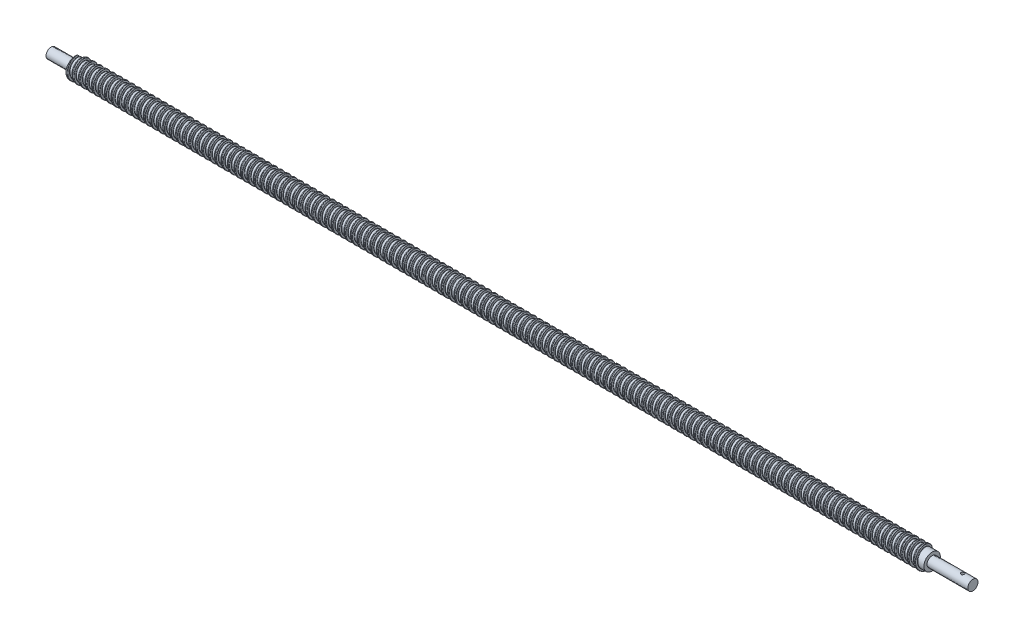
SolidWorks part; units mm, degrees
ref_plane "Plan de face" through (0, 0, 0) normal (0, 0, 1) x (1, 0, 0)
ref_plane "Plan de dessus" through (0, 0, 0) normal (0, 1, 0) x (1, 0, 0)
ref_plane "Plan de droite" through (0, 0, 0) normal (1, 0, 0) x (0, 0, -1)
sketch "Esquisse1" plane through (0, 0, 0) normal (0, 0, 1) x (1, 0, 0)
  line L0 (-448, 6.5) -> (-448, 0)
  line L1 (-448, 0) -> (275.5, 0)
  line L2 (275.5, 0) -> (275.5, 6.5)
  line L3 (275.5, 6.5) -> (-448, 6.5)
  line L4 (-448, 0) -> (275.5, 0) construction
  dimension "D1" = 6.5
  dimension "D2" = 723.5
revolve "Révolution1" add sketch "Esquisse1" angle 360 about L4
thread "Filetage1" pitch 5.08 start angle 0, offset 0, length 0, pitch 5.08, diameter 13
ref_plane "Plan2" through (-448, 0, -6.5) normal (0, -1, 0) x (0, 0, -1)
sketch "Profil de filetage2" plane through (-448, 0, -6.5) normal (0, -1, 0) x (0, 0, -1)
  line L0 (0, 0) -> (0, 5.08) construction
  line L1 (0, 0) -> (0, 3.5768)
  line L2 (0.254, 3.5768) -> (1.524, 3.5768) construction
  line L3 (1.524, 2.8818) -> (1.524, 2.1553)
  line L4 (1.3141, 3.1319) -> (0.2099, 3.3266)
  line L5 (1.3008, 1.6164) -> (0.2232, 0.5388)
  line L6 (0.762, 0) -> (1.524, 0) construction
  arc A0 (0.2099, 3.3266) -> (0, 3.5768) centre (0.254, 3.5768) cw
  arc A1 (0.2232, 0.5388) -> (0, 0) centre (0.762, 0) ccw
  arc A2 (1.524, 2.1553) -> (1.3008, 1.6164) centre (0.762, 2.1553) cw
  arc A3 (1.524, 2.8818) -> (1.3141, 3.1319) centre (1.27, 2.8818) ccw
  point P10 (1.524, 3.0949)
  point P17 (1.524, 1.8396)
  point P18 (0, 3.3636)
  point P19 (0, 0.3156)
  point P20 (0, 0)
  dimension "RootFillet1" = 0.254
  dimension "RootFillet2" = 0.762
  dimension "CrestFillet2" = 0.762
  dimension "CrestFillet1" = 0.254
  dimension "Pitch" = 5.08
  dimension "Angle1" = 10
  dimension "Angle2" = 45
  dimension "a" = 3.048
  dimension "b" = 1.524
  dimension "c" = 1.2553
sketch "Esquisse6" plane through (-448, 0, 0) normal (-1, 0, 0) x (0, 0, 1)
  circle A0 centre (0, 0) radius 4
  dimension "D1" = 8
extrude "Enlèv. mat.-Extru.1" cut sketch "Esquisse6" against normal blind 19.5 flip side to cut
sketch "Esquisse8" plane through (275.5, 0, 0) normal (1, 0, 0) x (0, 0, -1)
  circle A0 centre (0, 0) radius 4
  dimension "D1" = 8
extrude "Enlèv. mat.-Extru.5" cut sketch "Esquisse8" against normal blind 32 flip side to cut
hole_wizard "Diamètre du perçage Ø2.5 (2.5)1" positions "Esquisse3D1" profile "Esquisse9" hole size "Ø2.5" standard "Ansi Metric"
sketch3d "Esquisse3D1"
  point P0 (267.5, 4, 0)
  dimension "D1" = 24
sketch "Esquisse9" plane through (267.5, 4, 0) normal (1, 0, 0) x (0, 0, 1)
  line L0 (0, 0) -> (0, 13.2653)
  line L1 (0, 13.2653) -> (1.25, 13.2653)
  line L2 (1.25, 13.2653) -> (1.25, 0)
  line L5 (1.25, 0) -> (0, 0)
  line L11 (0, -6.35) -> (0, 107.95) construction
  dimension "Diamètre du perçage jusqu'au prochain" = 2.5
  dimension "Profondeur du perçage jusqu'au prochain" = 13.2653
